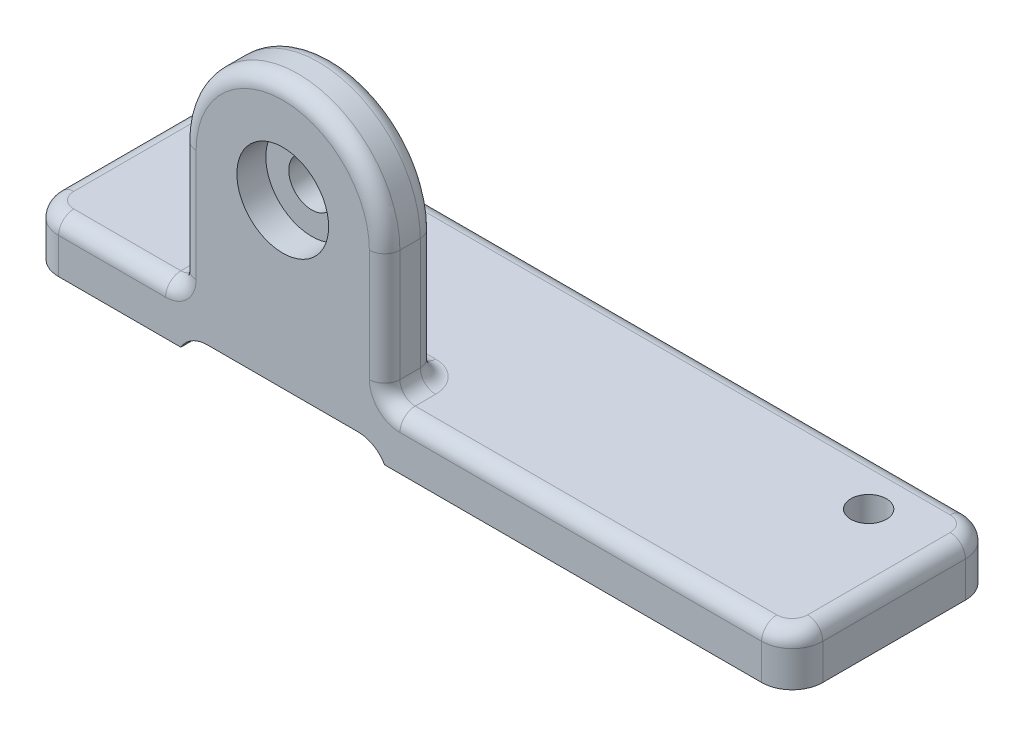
SolidWorks part; units mm, degrees
ref_plane "Front Plane" through (0, 0, 0) normal (0, 0, 1) x (1, 0, 0)
ref_plane "Top Plane" through (0, 0, 0) normal (0, 1, 0) x (1, 0, 0)
ref_plane "Right Plane" through (0, 0, 0) normal (1, 0, 0) x (0, 0, -1)
sketch "Sketch1" plane through (0, 0, 0) normal (0, 1, 0) x (1, 0, 0)
  line L1 (0, 0) -> (150, 0)
  line L2 (0, 0) -> (0, 40)
  line L3 (0, 40) -> (150, 40)
  line L4 (150, 0) -> (150, 40)
  dimension "D1" = 150
  dimension "D2" = 40
extrude "Base Plate" add sketch "Sketch1" along normal blind 10
sketch "Sketch2" plane through (0, 0, 0) normal (0, 0, 1) x (1, 0, 0)
  line L0 (30, 0) -> (30, 35)
  line L1 (0, 0) -> (150, 0) construction
  line L2 (70, 35) -> (70, 0)
  line L3 (70, 0) -> (30, 0)
  line L4 (0, 10) -> (0, 0) construction
  arc A0 (30, 35) -> (70, 35) centre (50, 35) cw
  dimension "D1" = 20
  dimension "D2" = 50
  dimension "D3" = 35
extrude "Vert Boss" add sketch "Sketch2" against normal blind 10
sketch "Sketch5" plane through (0, 0, 0) normal (0, 0, 1) x (1, 0, 0)
  line L0 (0, 0) -> (150, 0) construction
  line L1 (30, 0) -> (70, 0)
  line L2 (30, 0) -> (30, 3)
  line L3 (30, 3) -> (70, 3)
  line L4 (70, 0) -> (70, 3)
  line L5 (30, 35) -> (30, 10) construction
  line L6 (70, 10) -> (70, 35) construction
  dimension "D1" = 3
extrude "Slot" cut sketch "Sketch5" against normal through all
hole_wizard "Ø7.0 (7) Diameter Hole1" positions "Sketch9" profile "Sketch8" hole size "Ø7.0" standard "Ansi Metric"
sketch "Sketch9" plane through (0, 10, 0) normal (0, 1, 0) x (-1, 0, 0)
  line L0 (-150, 0) -> (-150, -40) construction
  line L1 (-150, -40) -> (0, -40) construction
  line L2 (0, -40) -> (0, 0) construction
  point P0 (-135, -30)
  point P1 (-15, -30)
  dimension "D1" = 15
  dimension "D2" = 10
  dimension "D3" = 15
sketch "Sketch8" plane through (135, 10, -30) normal (1, 0, 0) x (0, 0, 1)
  line L0 (0, 0) -> (0, 10)
  line L1 (0, 10) -> (3.5, 10)
  line L2 (3.5, 10) -> (3.5, 0)
  line L5 (3.5, 0) -> (0, 0)
  line L11 (0, -6.35) -> (0, 107.95) construction
  dimension "Thru Hole Dia." = 7
  dimension "Thru Hole Depth" = 10
hole_wizard "CBORE for M8 Hex Head Bolt1" positions "Sketch4" profile "Sketch3" counterbore size "M8" standard "Ansi Metric"
sketch "Sketch4" plane through (0, 0, 0) normal (0, 0, 1) x (1, 0, 0)
  point P0 (50, 35)
sketch "Sketch3" plane through (50, 35, 0) normal (1, 0, 0) x (0, -1, 0)
  line L0 (0, 0) -> (0, 40)
  line L1 (0, 40) -> (4.5, 40)
  line L3 (4.5, 40) -> (4.5, 5.68)
  line L4 (4.5, 5.68) -> (9.005, 5.68)
  line L5 (9.005, 5.68) -> (9.005, 0)
  line L7 (9.005, 0) -> (0, 0)
  line L11 (0, -6.35) -> (0, 107.95) construction
  dimension "Thru Hole Dia." = 9
  dimension "Thru Hole Depth" = 40
  dimension "C'Bore Dia." = 18.01
  dimension "C'Bore Depth" = 5.68
fillet "Fillet1" radius 6 6 edges at (70, 3, -20) (30, 3, -20) (0, 5, 0) (0, 5, -40) (150, 5, -40) (150, 5, 0)
fillet "Fillet2" radius 3 18 edges at (1.7574, 10, -38.2426) (0, 10, -20) (75, 10, -40) (1.7574, 10, -1.7574) (148.2426, 10, -38.2426) (18, 10, 0) (150, 10, -20) (30, 10, -5) (148.2426, 10, -1.7574) (50, 10, -10) (107, 10, 0) (70, 22.5, -10) (30, 22.5, -10) (70, 22.5, 0) (30, 22.5, 0) (70, 10, -5) (50, 55, -10) (50, 55, 0)
